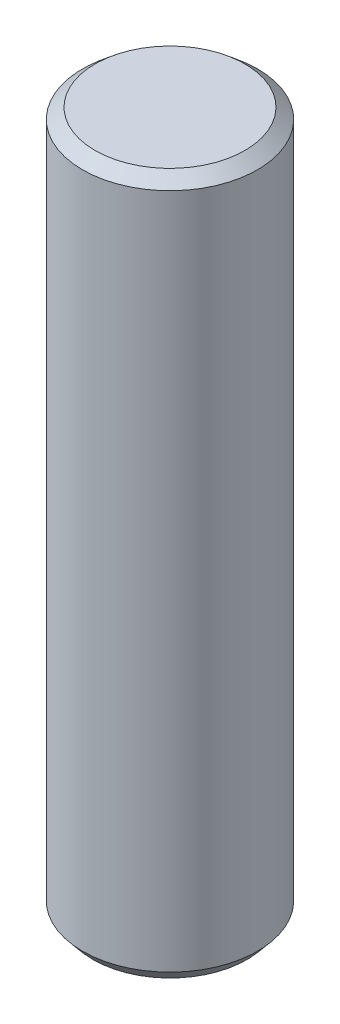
SolidWorks part; units mm, degrees
ref_plane "Front" through (0, 0, 0) normal (0, 0, 1) x (1, 0, 0)
ref_plane "Top" through (0, 0, 0) normal (0, 1, 0) x (1, 0, 0)
ref_plane "Right" through (0, 0, 0) normal (1, 0, 0) x (0, 0, -1)
sketch "Sketch1" plane through (0, 0, 0) normal (0, 1, 0) x (1, 0, 0)
  circle A0 centre (0, 0) radius 2.5
  dimension "D1" = 5
extrude "Boss-Extrude1" add sketch "Sketch1" along normal mid plane 20
chamfer "Chamfer1" distance 0.3 angle 50 2 edges at (0, -10, 2.5) (0, 10, 2.5)
